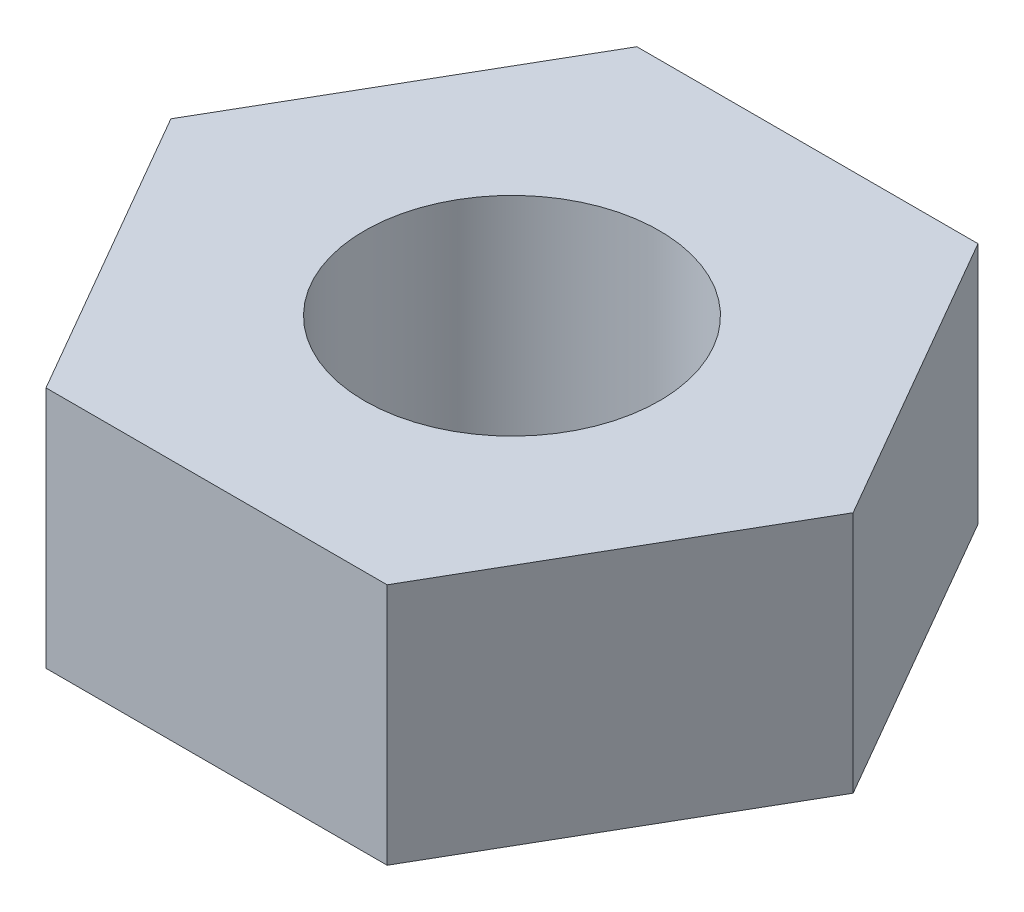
SolidWorks part; units mm, degrees
ref_plane "Front Plane" through (0, 0, 0) normal (0, 0, 1) x (1, 0, 0)
ref_plane "Top Plane" through (0, 0, 0) normal (0, 1, 0) x (1, 0, 0)
ref_plane "Right Plane" through (0, 0, 0) normal (1, 0, 0) x (0, 0, -1)
sketch "Sketch1" plane through (0, 0, 0) normal (0, 1, 0) x (1, 0, 0)
  line L0 (0, 0) -> (6.3624, 0)
  line L1 (6.3624, 0) -> (9.5436, 5.51)
  line L2 (9.5436, 5.51) -> (6.3624, 11.02)
  line L3 (6.3624, 11.02) -> (0, 11.02)
  line L4 (0, 11.02) -> (-3.1812, 5.51)
  line L5 (-3.1812, 5.51) -> (0, 0)
  point P3 (31.0057, 53.7035)
  dimension "D1" = 120
  dimension "D2" = 120
  dimension "D3" = 11.02
extrude "Boss-Extrude1" add sketch "Sketch1" along normal blind 4.53
sketch "Sketch2" plane through (0, 4.53, 0) normal (0, 1, 0) x (1, 0, 0)
  line L0 (-3.1812, 5.51) -> (9.5436, 5.51) construction
  circle A0 centre (3.1812, 5.51) radius 2.75
  dimension "D1" = 5.5
extrude "Cut-Extrude1" cut sketch "Sketch2" against normal through all
